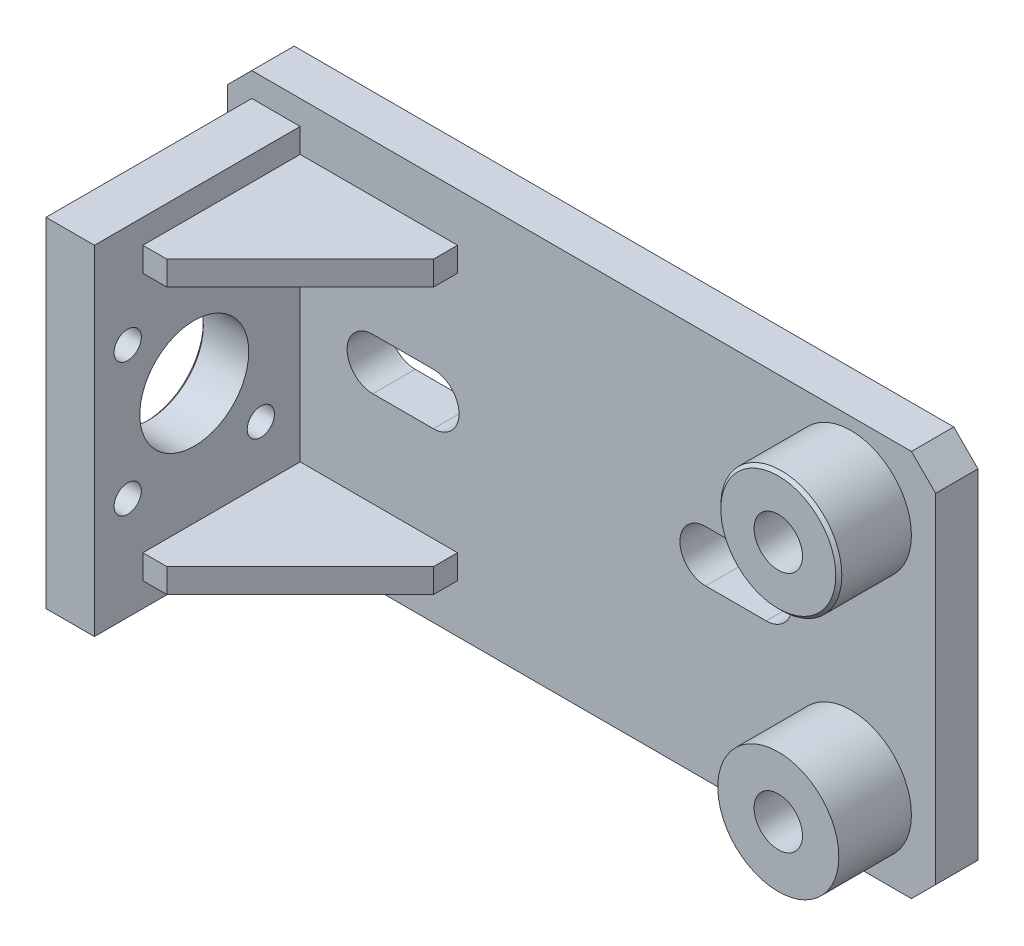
SolidWorks part; units mm, degrees
ref_plane "Plane1" through (0, 0, 0) normal (0, 0, 1) x (1, 0, 0)
ref_plane "Plane2" through (0, 0, 0) normal (0, 1, 0) x (1, 0, 0)
ref_plane "Plane3" through (0, 0, 0) normal (1, 0, 0) x (0, 0, -1)
sketch "Esquisse1" plane through (0, 0, 0) normal (0, 0, 1) x (1, 0, 0)
  line L0 (-89, 32) -> (28, 32)
  line L1 (-89, 32) -> (-89, -32)
  line L2 (28, -32) -> (-89, -32)
  line L3 (28, -32) -> (28, 32)
  dimension "D1" = 117
  dimension "D2" = 64
  dimension "D3" = 32
  dimension "D4" = 28
extrude "Base-Extrusion" add sketch "Esquisse1" along normal blind 7
chamfer "Chanfrein1" distance 4 angle 45 4 edges at (-89, 32, 3.5) (28, 32, 3.5) (28, -32, 3.5) (-89, -32, 3.5)
sketch "Esquisse2" plane through (0, 0, 7) normal (0, 0, 1) x (1, 0, 0)
  line L0 (28, -28) -> (28, 28) construction
  line L1 (-85, 32) -> (24, 32) construction
  circle A0 centre (14, 20) radius 10
  dimension "D3" = 20
  dimension "D1" = 14
  dimension "D2" = 12
extrude "Boss.-Extru.1" add sketch "Esquisse2" along normal blind 12
sketch "Esquisse3" plane through (0, 0, 19) normal (0, 0, 1) x (1, 0, 0)
  circle A0 centre (14, 20) radius 4
  dimension "D1" = 8
chamfer "Chanfrein3" distance 0.5 angle 45 1 edges at (24, 20, 19)
sketch "Esquisse5" plane through (2.3886, -32.1204, 7) normal (0, 0, 1) x (1, 0, 0)
  line L0 (21.6114, 0.1204) -> (-87.3886, 0.1204) construction
  line L1 (25.6114, 4.1204) -> (25.6114, 60.1204) construction
  circle A0 centre (11.6114, 12.1204) radius 10
  dimension "D1" = 12
  dimension "D2" = 14
extrude "Boss.-Extru.4" add sketch "Esquisse5" along normal blind 12
sketch "Esquisse6" plane through (6.2435, -28.3757, 19) normal (0, 0, 1) x (1, 0, 0)
  circle A0 centre (7.7565, 8.3757) radius 4
  dimension "D1" = 8
sketch "Esquisse7" plane through (0, 0, 7) normal (0, 0, 1) x (1, 0, 0)
  line L0 (-85, 28) -> (-77, 28)
  line L1 (-85, 28) -> (-85, -28)
  line L2 (-77, -28) -> (-85, -28)
  line L3 (-77, -28) -> (-77, 28)
  line L8 (-89, 28) -> (-89, -28) construction
  line L9 (-89, 0) -> (28, 0) construction
  dimension "D1" = 8
  dimension "D2" = 56
  dimension "D3" = 4
  dimension "D7" = 28
extrude "Boss.-Extru.7" add sketch "Esquisse7" along normal blind 34
sketch "Esquisse10" plane through (-77, 0, 0) normal (1, 0, 0) x (0, 0, -1)
  line L0 (-7, -24) -> (-33, -24)
  line L1 (-7, -24) -> (-7, -20)
  line L2 (-33, -20) -> (-7, -20)
  line L3 (-33, -20) -> (-33, -24)
  line L4 (-7, -28) -> (-7, 28) construction
  line L5 (-41, -28) -> (-7, -28) construction
  dimension "D1" = 4
  dimension "D2" = 4
  dimension "D3" = 26
extrude "Boss.-Extru.9" add sketch "Esquisse10" along normal blind 26
chamfer "Chanfrein6" distance 22 angle 45 1 edges at (-51, -22, 33)
sketch "Esquisse12" plane through (-77, 31.7977, 13.3557) normal (1, 0, 0) x (0, 0, -1)
  line L0 (6.3557, -11.7977) -> (-19.6443, -11.7977)
  line L1 (6.3557, -11.7977) -> (6.3557, -7.7977)
  line L2 (-19.6443, -7.7977) -> (6.3557, -7.7977)
  line L3 (-19.6443, -7.7977) -> (-19.6443, -11.7977)
  line L4 (6.3557, -51.7977) -> (6.3557, -3.7977) construction
  line L5 (-27.6443, -3.7977) -> (6.3557, -3.7977) construction
  dimension "D1" = 4
  dimension "D2" = 4
  dimension "D3" = 26
extrude "Boss.-Extru.11" add sketch "Esquisse12" along normal blind 26
chamfer "Chanfrein7" distance 22 angle 45 1 edges at (-51, 22, 33)
sketch "Esquisse13" plane through (-77, 0, 0) normal (1, 0, 0) x (0, 0, -1)
  line L0 (-41, -28) -> (-7, -28) construction
  line L1 (-7, -20) -> (-7, 20) construction
  circle A0 centre (-24.5, 0) radius 9
  dimension "D1" = 18
  dimension "D2" = 28
  dimension "D3" = 17.5
extrude "Enlèv. mat.-Extru.1" cut sketch "Esquisse13" against normal through all
chamfer "Chanfrein8" distance 0.5 angle 45 1 edges at (-85, 0, 15.5)
extrude "Enlèv. mat.-Extru.2" cut sketch "Esquisse3" against normal through all
extrude "Enlèv. mat.-Extru.3" cut sketch "Esquisse6" against normal through all
sketch "Esquisse14" plane through (-85, 0, 0) normal (-1, 0, 0) x (0, 0, 1)
  circle A0 centre (35.5, 11) radius 2.25
  circle A1 centre (13.5, 11) radius 2.25
  circle A2 centre (13.5, -11) radius 2.25
  circle A3 centre (35.5, -11) radius 2.25
  circle A4 centre (24.5, 0) radius 9 construction
  circle A5 centre (24.5, 0) radius 9.5 construction
  dimension "D3" = 11
  dimension "D4" = 11
  dimension "D5" = 4.5
  dimension "D1" = 22
  dimension "D2" = 22
extrude "Enlèv. mat.-Extru.4" cut sketch "Esquisse14" against normal blind 10
sketch "Esquisse15" plane through (0, 0, 7) normal (0, 0, 1) x (1, 0, 0)
  line L0 (-10, 4.25) -> (0, 4.25)
  line L1 (0, -4.25) -> (-10, -4.25)
  line L2 (-65, 4.25) -> (-55, 4.25)
  line L3 (-65, -4.25) -> (-55, -4.25)
  arc A0 (-65, 4.25) -> (-65, -4.25) centre (-65, 0) ccw
  arc A1 (0, -4.25) -> (0, 4.25) centre (0, 0) ccw
  arc A2 (-10, 4.25) -> (-10, -4.25) centre (-10, 0) ccw
  arc A3 (-55, -4.25) -> (-55, 4.25) centre (-55, 0) ccw
  dimension "D1" = 8.5
  dimension "D2" = 8.5
  dimension "D5" = 10
  dimension "D3" = 65
  dimension "D6" = 10
extrude "Enlèv. mat.-Extru.5" cut sketch "Esquisse15" against normal blind 10
